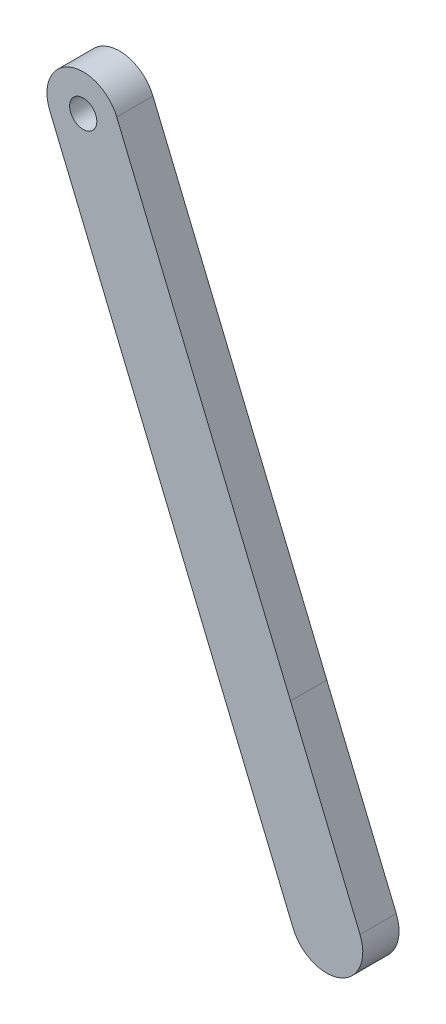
SolidWorks part; units mm, degrees
ref_plane "前视基准面" through (0, 0, 0) normal (0, 0, 1) x (1, 0, 0)
ref_plane "上视基准面" through (0, 0, 0) normal (0, 1, 0) x (1, 0, 0)
ref_plane "右视基准面" through (0, 0, 0) normal (1, 0, 0) x (0, 0, -1)
sketch "草图1" plane through (0, 0, 0) normal (0, 0, 1) x (1, 0, 0)
  line L1 (-4.113, -24.624) -> (3.5525, -43.0968)
  line L2 (-21.5446, 17.3843) -> (-13.6945, -1.5331)
  line L3 (-21.5446, 17.3843) -> (-25.6936, 27.383)
  line L4 (-13.6945, -1.5331) -> (-4.113, -24.624)
  line L5 (-6.3053, 1.5332) -> (3.2767, -21.5576)
  line L7 (22.4207, -67.691) -> (22.4607, -67.7874)
  line L8 (3.2767, -21.5576) -> (10.9422, -40.0304)
  line L10 (-15.8873, 24.624) -> (-6.3053, 1.5332)
  arc A0 (22.4607, -67.7874) -> (22.4207, -67.691) centre (18.7456, -69.2726) ccw
  arc A1 (-15.6731, 22.2416) -> (-15.6671, 22.2693) centre (-19.5819, 23.0909) ccw
  arc A2 (-4.113, -24.624) -> (-4.113, -24.6241) centre (-0.4181, -23.0909) ccw
  circle A3 centre (-19.5819, 23.0909) radius 1.5
  arc A4 (3.5525, -43.0968) -> (10.9422, -40.0304) centre (7.2473, -41.5636) ccw
  arc A6 (-15.6731, 22.2416) -> (-23.2764, 21.5578) centre (-19.5819, 23.0909) ccw
  arc A8 (-17.1206, 26.244) -> (-23.2764, 21.5578) centre (-19.5819, 23.0909) ccw
  point P2 (0, 0)
extrude "凸台-拉伸1" add sketch "草图1" along normal blind 4
